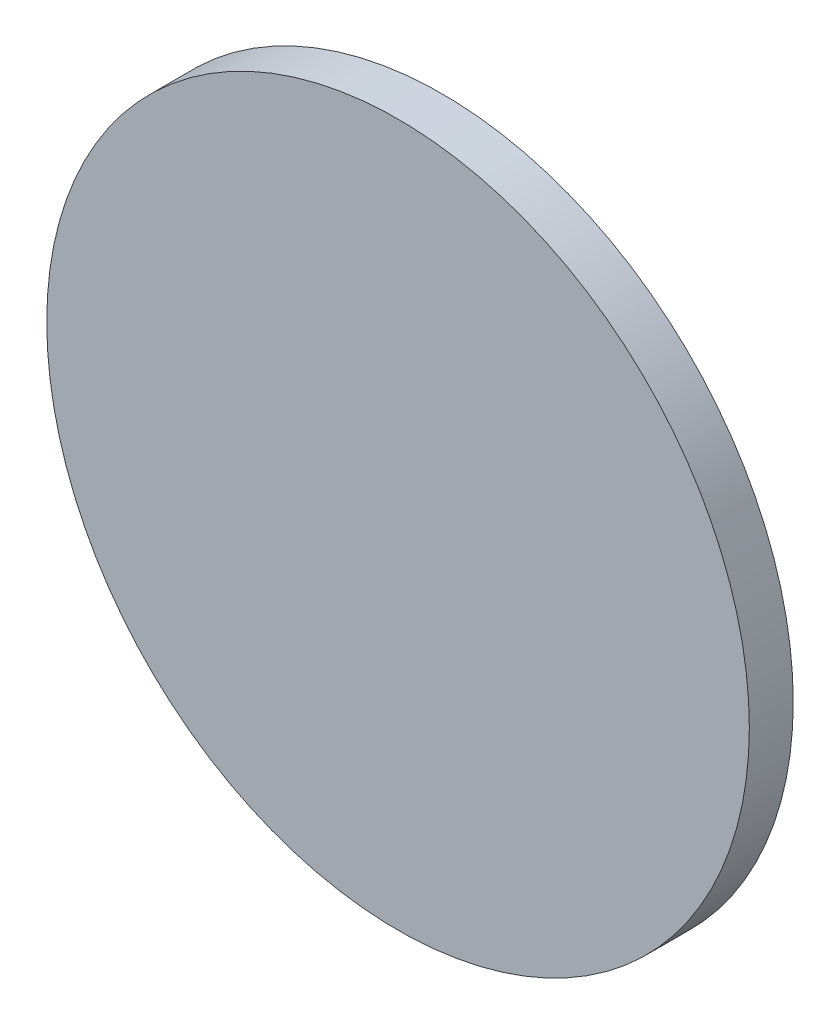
SolidWorks part; units mm, degrees
ref_plane "Front" through (0, 0, 0) normal (0, 0, 1) x (1, 0, 0)
ref_plane "Top" through (0, 0, 0) normal (0, 1, 0) x (1, 0, 0)
ref_plane "Right" through (0, 0, 0) normal (1, 0, 0) x (0, 0, -1)
sketch "Sketch1" plane through (0, 0, 0) normal (0, 0, 1) x (1, 0, 0)
  circle A0 centre (0, 0) radius 25.4
extrude "Boss-Extrude1" add sketch "Sketch1" along normal blind 3.175
